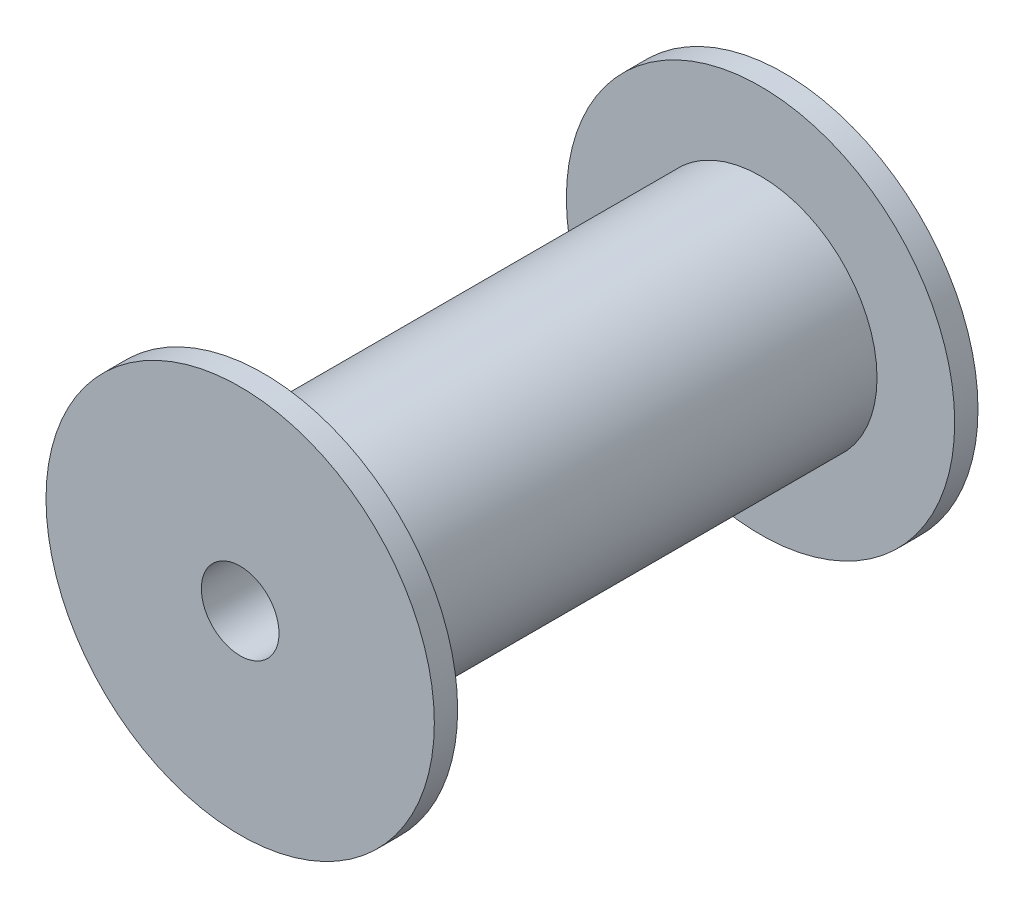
SolidWorks part; units mm, degrees
ref_plane "Alzado" through (0, 0, 0) normal (0, 0, 1) x (1, 0, 0)
ref_plane "Planta" through (0, 0, 0) normal (0, 1, 0) x (1, 0, 0)
ref_plane "Vista lateral" through (0, 0, 0) normal (1, 0, 0) x (0, 0, -1)
sketch3d "Sk_Cuerpo"
  line L0 (-425.1, 65, -50) -> (-425.1, 65, 25.5)
sweep "Cuerpo" add path "Sk_Cuerpo" parameters "D3"=30
sketch3d "Sk_Brida_izq"
  line L0 (-425.1, 65, -44.5) -> (-425.1, 65, -41.5)
sweep "Brida_izq" add path "Sk_Brida_izq" parameters "D3"=50
sketch3d "Sk_Brida_dcha"
  line L0 (-425.1, 65, 22.5) -> (-425.1, 65, 25.5)
sweep "Brida_dcha" add path "Sk_Brida_dcha" parameters "D3"=50
sketch3d "Sk_Taladro_eje"
  line L0 (-425.1, 65, -50) -> (-425.1, 65, 25.5)
sweep "Taladro_eje" cut path "Sk_Taladro_eje" parameters "D3"=10
sketch3d "Sk_Alojamiento_rodamiento_izq"
  line L0 (-425.1, 65, -50) -> (-425.1, 65, -42)
sweep "Alojamiento_rodamiento_izq" cut path "Sk_Alojamiento_rodamiento_izq" parameters "D3"=26
